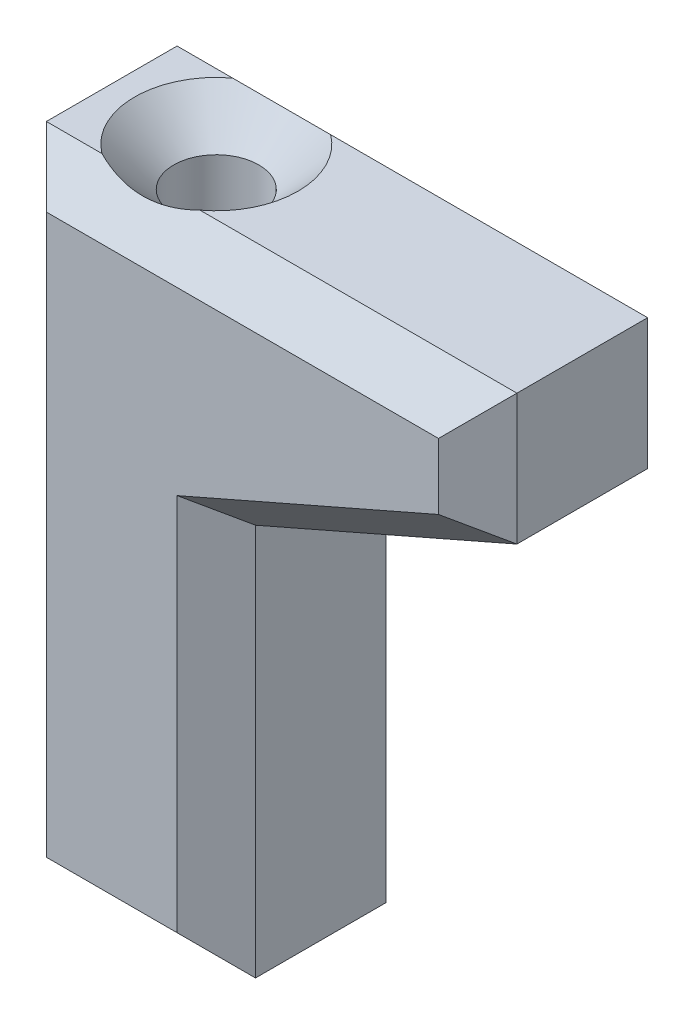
SolidWorks part; units mm, degrees
ref_plane "Plan de face" through (0, 0, 0) normal (0, 0, 1) x (1, 0, 0)
ref_plane "Plan de dessus" through (0, 0, 0) normal (0, 1, 0) x (1, 0, 0)
ref_plane "Plan de droite" through (0, 0, 0) normal (1, 0, 0) x (0, 0, -1)
sketch "Esquisse1" plane through (0, 0, 0) normal (0, 0, 1) x (1, 0, 0)
  line L0 (8, 0) -> (-8, 0)
  line L1 (-8, 0) -> (-8, 48.75)
  line L2 (-8, 48.75) -> (28, 48.75)
  line L3 (28, 48.75) -> (28, 38.75)
  line L4 (28, 38.75) -> (8, 30)
  line L5 (8, 30) -> (8, 0)
  line L6 (0, 0) -> (0, -23) construction
  dimension "D1" = 30
  dimension "D2" = 16
  dimension "D3" = 20
  dimension "D4" = 10
extrude "Boss.-Extru.1" add sketch "Esquisse1" along normal mid plane 16
sketch "Esquisse2" plane through (0, 0, 0) normal (0, -1, 0) x (1, 0, 0)
  circle A0 centre (0, 0) radius 3.25
  dimension "D1" = 6.5
extrude "Enlèv. mat.-Extru.1" cut sketch "Esquisse2" against normal through all
chamfer "Chanfrein1" distance 3 angle 45 13 edges at (18, 34.375, -8) (28, 43.75, -8) (10, 48.75, -8) (-8, 24.375, -8) (0, 0, -8) (8, 15, -8) (0, 0, 8) (-8, 24.375, 8) (10, 48.75, 8) (28, 43.75, 8) (18, 34.375, 8) (8, 15, 8) (3.25, 48.75, 0)
